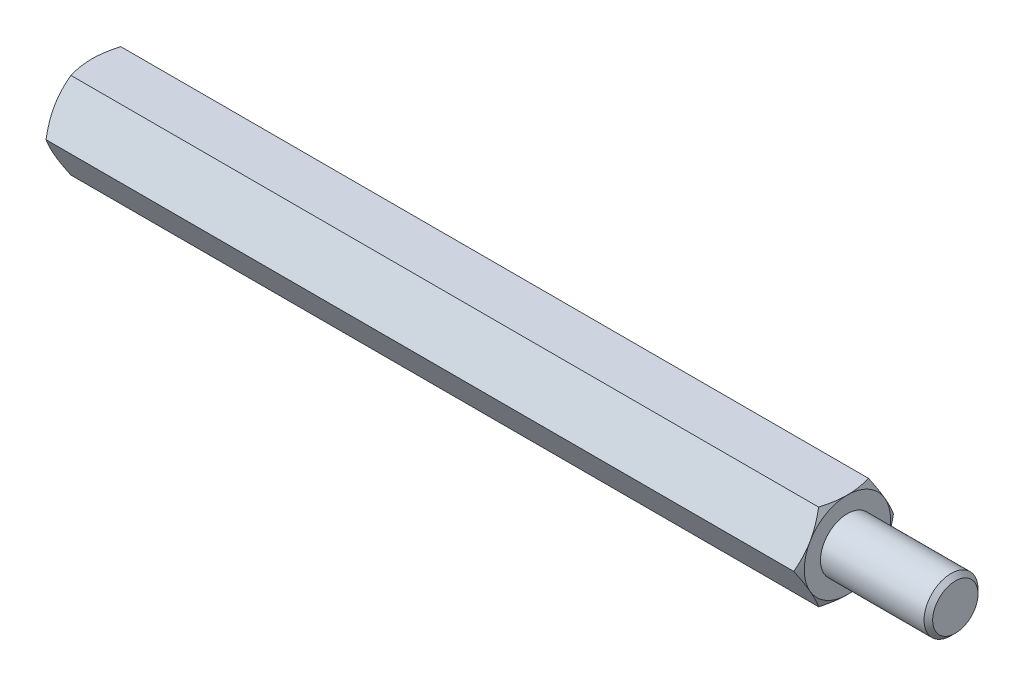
SolidWorks part; units mm, degrees
ref_plane "Front Plane" through (0, 0, 0) normal (0, 0, 1) x (1, 0, 0)
ref_plane "Top Plane" through (0, 0, 0) normal (0, 1, 0) x (1, 0, 0)
ref_plane "Right Plane" through (0, 0, 0) normal (1, 0, 0) x (0, 0, -1)
sketch "Sketch1" plane through (0, 0, 0) normal (1, 0, 0) x (0, 0, -1)
  line L1 (2.3094, 4) -> (-2.3094, 4)
  line L2 (-2.3094, 4) -> (-4.6188, 0)
  line L3 (-4.6188, 0) -> (-2.3094, -4)
  line L4 (-2.3094, -4) -> (2.3094, -4)
  line L5 (2.3094, -4) -> (4.6188, 0)
  line L6 (4.6188, 0) -> (2.3094, 4)
  circle A0 centre (0, 0) radius 4 construction
  dimension "D1" = 8
extrude "Extrude2" add sketch "Sketch1" along normal mid plane 70
sketch "Sketch2" plane through (0, 0, 0) normal (0, 0, 1) x (1, 0, 0)
  line L0 (-35, 4) -> (-33.5, 6.5981)
  line L1 (-35, 7) -> (-35, 4)
  line L3 (0, 0) -> (50000, 0) construction
  arc A0 (-33.5, 6.5981) -> (-35, 7) centre (-34.1962, 7) ccw
  dimension "D1" = 30
  dimension "D2" = 3
revolve "Cut-Revolve1" cut sketch "Sketch2" angle 360 about L3
mirror "Mirror1" about plane through (0, 0, 0) normal (1, 0, 0) of "Cut-Revolve1"
sketch "Sketch3" plane through (-35, 0, 0) normal (-1, 0, 0) x (0, 0, 1)
  circle A0 centre (0, 0) radius 2.1
  dimension "D1" = 4.2
extrude "Extrude3" cut sketch "Sketch3" against normal blind 10
sketch "Sketch4" plane through (0, 0, 0) normal (0, 0, 1) x (1, 0, 0)
  line L0 (-25, 0) -> (-25, 2.1)
  line L1 (34.6427, 0) -> (-34.6427, 0) construction
  line L2 (-25, 2.1) -> (-23.7876, 0)
  line L3 (-23.7876, 0) -> (-25, 0)
  line L4 (-35, 2) -> (-35, -2) construction
  point P4 (-35, 0)
  dimension "D1" = 30
  dimension "D2" = 2.1
  dimension "D3" = 10
revolve "Cut-Revolve2" cut sketch "Sketch4" angle 360 about L3
sketch "Sketch5" plane through (35, 0, 0) normal (1, 0, 0) x (0, 0, -1)
  circle A0 centre (0, 0) radius 2.5
  dimension "D1" = 5
extrude "Extrude4" add sketch "Sketch5" along normal blind 10
chamfer "Chamfer1" distance 0.4 angle 45 1 edges at (45, 0, -2.5)
equation "\"D2@Sketch4\" = \"D1@Sketch3\"/2"
